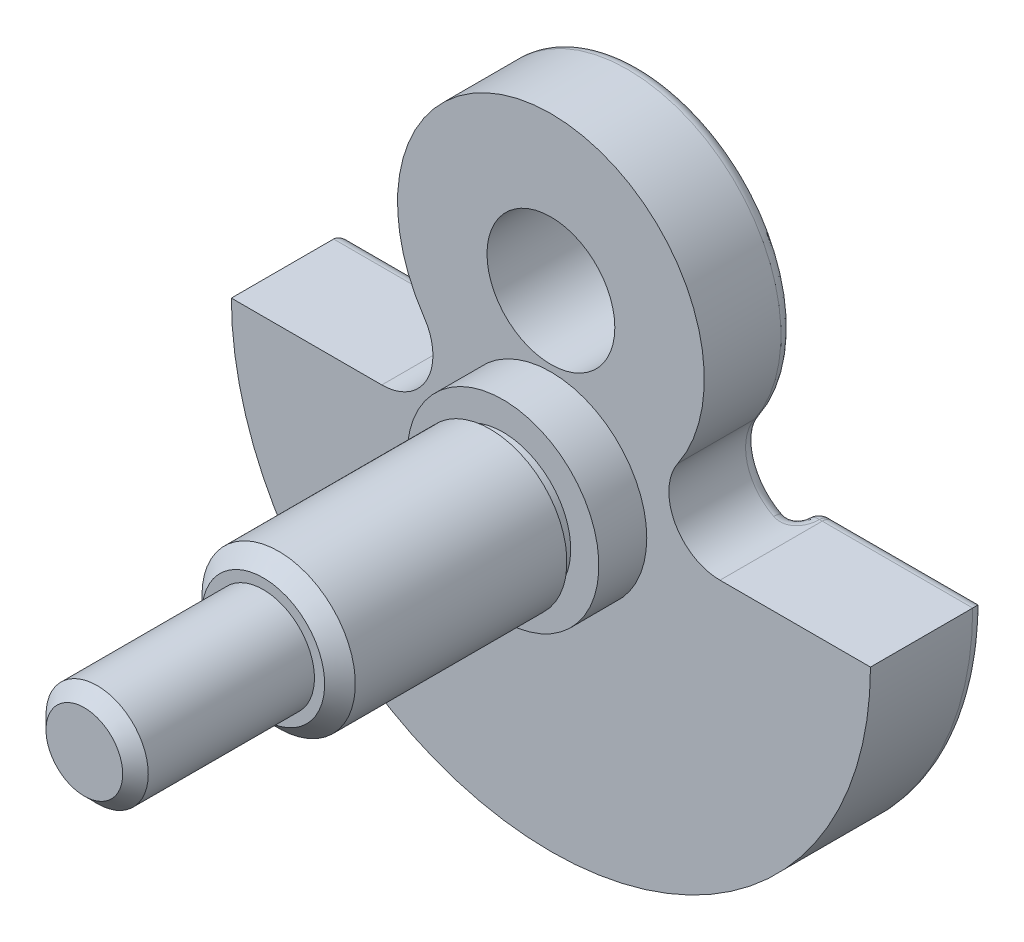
SolidWorks part; units mm, degrees
ref_plane "Plan1" through (0, 0, 0) normal (0, 0, 1) x (1, 0, 0)
ref_plane "Plan2" through (0, 0, 0) normal (0, 1, 0) x (1, 0, 0)
ref_plane "Plan3" through (0, 0, 0) normal (1, 0, 0) x (0, 0, -1)
ref_plane "Plan4" through (0, 0, 12.5) normal (0, 0, 1) x (1, 0, 0)
sketch "Esquisse2" plane through (0, 0, 12.5) normal (0, 0, 1) x (1, 0, 0)
  line L0 (-50, 0) -> (-26.4575, 0)
  line L1 (0, 39.0928) -> (0, -36.6911) construction
  line L2 (26.4575, 0) -> (50, 0)
  arc A0 (-50, 0) -> (50, 0) centre (0, 0) ccw
  arc A1 (19.8431, 12.5) -> (-19.8431, 12.5) centre (0, 26) ccw
  arc A2 (-26.4575, 0) -> (-19.8431, 12.5) centre (-26.4575, 8) ccw
  arc A3 (26.4575, 0) -> (19.8431, 12.5) centre (26.4575, 8) cw
  dimension "D2" = 48
  dimension "D3" = 100
  dimension "D4" = 16
  dimension "D1" = 26
extrude "Base-Extrusion" add sketch "Esquisse2" against normal blind 18
sketch "Esquisse3" plane through (0, 0, -5.5) normal (0, 0, -1) x (-1, 0, 0)
  arc A0 (-23.0256, 6.7692) -> (23.0256, 6.7692) centre (0, 0) ccw
  arc A1 (23.0256, 6.7692) -> (-23.0256, 6.7692) centre (0, 26) ccw
  dimension "D1" = 48
  dimension "D2" = 30
extrude "Enlèv. mat.-Extru.1" cut sketch "Esquisse3" against normal blind 4
fillet "Congé1" radius 2
sketch "Esquisse4" plane through (0, 0, 0) normal (1, 0, 0) x (0, 0, -1)
  line L0 (-12.5, 0) -> (-12.5, 15)
  line L2 (-12.5, 15) -> (-20, 15)
  line L3 (-20, 15) -> (-20, 10.6)
  line L4 (-20, 10.6) -> (-22, 10.6)
  line L6 (-22, 10.6) -> (-22, 12)
  line L7 (-12.5, 50) -> (-12.5, -50) construction
  line L8 (-55.1, 12) -> (-57.5, 9.6)
  line L9 (-57.5, 9.6) -> (-57.5, 8)
  line L11 (-85.5, 8) -> (-85.5, 0)
  line L12 (-85.5, 0) -> (-12.5, 0)
  line L15 (-22, 12) -> (-55.1, 12)
  line L16 (-9.4907, 0) -> (-55.6107, 0) construction
  line L17 (3.5, 0) -> (-12.5, 0) construction
  line L18 (-85.5, 8) -> (-57.5, 8)
  dimension "D1" = 15
  dimension "D2" = 2
  dimension "D3" = 1.4
  dimension "D4" = 7.5
  dimension "D5" = 45
  dimension "D6" = 28
  dimension "D7" = 12
  dimension "D8" = 2.4
  dimension "D9" = 45
  dimension "D10" = 8
revolve "Boss.-Révol.1" add sketch "Esquisse4"
chamfer "Chanfrein1" distance 2 angle 45
sketch "Esquisse5" plane through (0, 0, -1.5) normal (0, 0, -1) x (-1, 0, 0)
  circle A0 centre (0, 26) radius 18
  dimension "D1" = 36
extrude "Boss.-Extru.1" add sketch "Esquisse5" along normal blind 1
fillet "Congé2" radius 1.9
sketch "Esquisse6" plane through (0, 0, -2.5) normal (0, 0, -1) x (-1, 0, 0)
  circle A0 centre (0, 26) radius 10
  dimension "D1" = 20
extrude "Enlèv. mat.-Extru.3" cut sketch "Esquisse6" against normal through all
